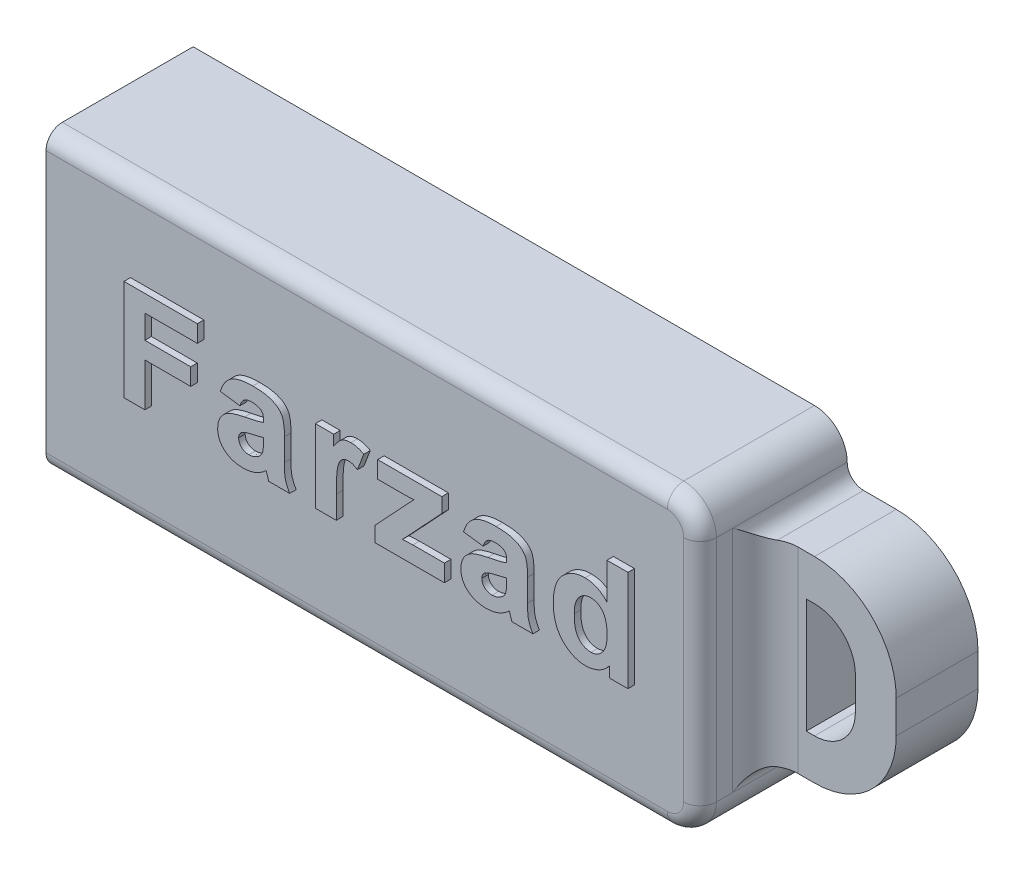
SolidWorks part; units mm, degrees
ref_plane "Front Plane" through (0, 0, 0) normal (0, 0, 1) x (1, 0, 0)
ref_plane "Top Plane" through (0, 0, 0) normal (0, 1, 0) x (1, 0, 0)
ref_plane "Right Plane" through (0, 0, 0) normal (1, 0, 0) x (0, 0, -1)
sketch "Sketch1" plane through (0, 0, 0) normal (0, 0, 1) x (1, 0, 0)
  line L1 (-20, -9) -> (20, -9)
  line L2 (-20, -9) -> (-20, 9)
  line L3 (-20, 9) -> (20, 9)
  line L4 (20, -9) -> (20, 9)
  line L5 (-20, -9) -> (20, 9) construction
  line L6 (-20, 9) -> (20, -9) construction
  point P0 (0, 0)
  dimension "D1" = 18
  dimension "D2" = 40
extrude "Boss-Extrude1" add sketch "Sketch1" along normal blind 2
sketch "Sketch3" plane through (0, 0, 2) normal (0, 0, 1) x (1, 0, 0)
  line L0 (-20, -9) -> (20, -9) construction
  line L1 (20, -9) -> (20, 9) construction
  line L2 (-20, 9) -> (-20, -9) construction
  line L3 (20, 9) -> (-20, 9) construction
  line L4 (-20, -9) -> (20, -9)
  line L5 (20, -9) -> (20, 9)
  line L6 (-20, 9) -> (-20, 6.2)
  line L7 (20, 9) -> (-20, 9)
  line L8 (17, 7) -> (-17, 7)
  line L9 (-17, 7) -> (-17, 6.2)
  line L10 (-17, -7) -> (17, -7)
  line L11 (17, -7) -> (17, 7)
  line L12 (-17, 6.2) -> (-20, 6.2)
  line L13 (-17, -6.2) -> (-20, -6.2)
  line L14 (20, 0) -> (17, 0) construction
  line L15 (-17, -6.2) -> (-17, -7)
  line L16 (-20, -6.2) -> (-20, -9)
  dimension "D2" = 3
  dimension "D1" = 3
  dimension "D3" = 6.2
  dimension "D4" = 6.2
extrude "Boss-Extrude2" add sketch "Sketch3" along normal blind 5
sketch "Sketch4" plane through (0, 0, 2) normal (0, 0, 1) x (1, 0, 0)
  line L8 (-20, -6.2) -> (-17, -6.2)
  line L9 (-17, -6.2) -> (-17, -7)
  line L10 (-17, -7) -> (17, -7)
  line L11 (17, -7) -> (17, 7)
  line L12 (17, 7) -> (-17, 7)
  line L13 (-17, 7) -> (-17, 6.2)
  line L14 (-17, 6.2) -> (-20, 6.2)
  line L15 (-20, 6.2) -> (-20, -6.2)
  line L18 (-17, -7) -> (17, -7)
  line L19 (17, -7) -> (17, 7)
  line L20 (17, 7) -> (-17, 7)
  line L21 (-17, 7) -> (-17, -7)
  dimension "D1" = 0
extrude "Boss-Extrude3" add sketch "Sketch4" along normal blind 0.2
sketch "Sketch6" plane through (0, 0, 7) normal (0, 0, 1) x (1, 0, 0)
  line L1 (-20, 9) -> (20, 9)
  line L2 (-20, 9) -> (-20, -9)
  line L3 (-20, -9) -> (20, -9)
  line L4 (20, 9) -> (20, -9)
extrude "Boss-Extrude4" add sketch "Sketch6" along normal blind 2
sketch "Sketch8" plane through (0, 0, 7) normal (0, 0, -1) x (-1, 0, 0)
  line L1 (20, 6.2) -> (14, 6.2)
  line L2 (20, 6.2) -> (20, -6.2)
  line L3 (20, -6.2) -> (14, -6.2)
  line L4 (14, 6.2) -> (14, -6.2)
extrude "Cut-Extrude1" cut sketch "Sketch8" against normal blind 0.2
sketch "Sketch9" plane through (0, 0, 9) normal (0, 0, 1) x (1, 0, 0)
  text T0 "<b>Farzad</b>" font "Arial Narrow" height in points 24
extrude "Boss-Extrude5" add sketch "Sketch9" along normal blind 0.4
sketch "Sketch10" plane through (20, 0, 0) normal (1, 0, 0) x (0, 0, -1)
  line L0 (0, -9) -> (0, 9) construction
  line L1 (-5, -6) -> (0, -6)
  line L2 (-5, -6) -> (-5, 6)
  line L3 (-5, 6) -> (0, 6)
  line L4 (0, -6) -> (0, 6)
  point P0 (-4.5, 0)
  dimension "D1" = 5
extrude "Boss-Extrude6" add sketch "Sketch10" along normal blind 8
fillet "Fillet1" radius 5 2 edges at (28, 6, 2.5) (28, -6, 2.5)
sketch "Sketch12" plane through (0, 0, 5) normal (0, 0, 1) x (1, 0, 0)
  line L0 (25.5, -1) -> (25.5, 1)
  line L1 (23, 3.5) -> (22.5, 3.5)
  line L2 (22.5, 3.5) -> (22.5, -3.5)
  line L3 (22.5, -3.5) -> (23, -3.5)
  arc A0 (23, -3.5) -> (25.5, -1) centre (23, -1) ccw
  arc A1 (25.5, 1) -> (23, 3.5) centre (23, 1) ccw
extrude "Cut-Extrude3" cut sketch "Sketch12" against normal blind 8
fillet "Fillet2" radius 2 1 edges at (20, 0, 5)
fillet "Fillet4" radius 2 2 edges at (20, -9, 4.5) (20, 9, 4.5)
fillet "Fillet6" radius 1 5 edges at (-1, -9, 9) (19.4142, -8.4142, 9) (-1, 9, 9) (19.4142, 8.4142, 9) (20, 0, 9)
fillet "Fillet7" radius 1 2 edges at (20, -6, 3.5) (20, 6, 3.5)
